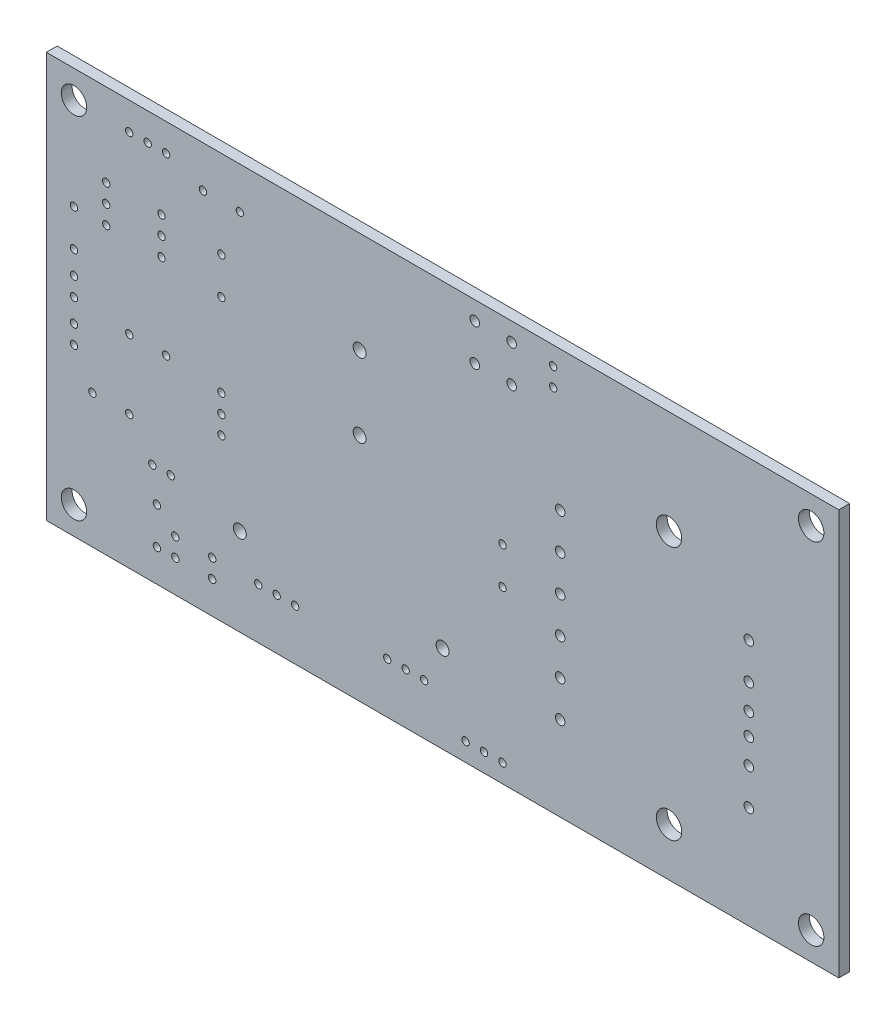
SolidWorks part; units mm, degrees
ref_plane "Спереди" through (0, 0, 0) normal (0, 0, 1) x (1, 0, 0)
ref_plane "Сверху" through (0, 0, 0) normal (0, 1, 0) x (1, 0, 0)
ref_plane "Справа" through (0, 0, 0) normal (1, 0, 0) x (0, 0, -1)
sketch "Эскиз1" plane through (0, 0, 0) normal (0, 0, 1) x (1, 0, 0)
  line L1 (0, 0) -> (109.22, 0)
  line L2 (0, 0) -> (0, -55.88)
  line L3 (0, -55.88) -> (109.22, -55.88)
  line L4 (109.22, 0) -> (109.22, -55.88)
extrude "Бобышка-Вытянуть1" add sketch "Эскиз1" along normal blind 1.4986
sketch "Эскиз2" plane through (0, 0, 1.4986) normal (0, 0, 1) x (1, 0, 0)
  circle A0 centre (3.81, -3.81) radius 1.7526
  circle A1 centre (3.81, -52.07) radius 1.7526
  circle A2 centre (105.41, -3.81) radius 1.7526
  circle A3 centre (105.41, -52.07) radius 1.7526
  circle A4 centre (11.43, -3.81) radius 0.508
  circle A5 centre (13.97, -3.81) radius 0.508
  circle A6 centre (16.51, -3.81) radius 0.508
  circle A7 centre (21.59, -5.715) radius 0.508
  circle A8 centre (26.67, -5.715) radius 0.508
  circle A9 centre (8.255, -11.43) radius 0.508
  circle A10 centre (8.255, -13.97) radius 0.508
  circle A11 centre (8.255, -16.51) radius 0.508
  circle A12 centre (15.875, -11.43) radius 0.508
  circle A13 centre (15.875, -13.97) radius 0.508
  circle A14 centre (15.875, -16.51) radius 0.508
  circle A15 centre (24.13, -12.065) radius 0.508
  circle A16 centre (24.13, -17.145) radius 0.508
  circle A17 centre (3.81, -16.51) radius 0.508
  circle A18 centre (3.81, -21.59) radius 0.508
  circle A19 centre (3.81, -24.765) radius 0.508
  circle A20 centre (3.81, -27.305) radius 0.508
  circle A21 centre (3.81, -30.48) radius 0.508
  circle A22 centre (3.81, -33.02) radius 0.508
  circle A23 centre (11.43, -27.94) radius 0.508
  circle A24 centre (16.51, -27.94) radius 0.508
  circle A25 centre (24.13, -28.575) radius 0.508
  circle A26 centre (24.13, -31.115) radius 0.508
  circle A27 centre (24.13, -33.655) radius 0.508
  circle A28 centre (6.35, -37.465) radius 0.508
  circle A29 centre (11.43, -37.465) radius 0.508
  circle A30 centre (14.605, -41.91) radius 0.508
  circle A31 centre (17.145, -41.91) radius 0.508
  circle A32 centre (15.24, -46.355) radius 0.508
  circle A33 centre (15.24, -51.435) radius 0.508
  circle A34 centre (17.78, -48.895) radius 0.508
  circle A35 centre (22.86, -48.895) radius 0.508
  circle A36 centre (17.78, -51.435) radius 0.508
  circle A37 centre (22.86, -51.435) radius 0.508
  circle A38 centre (26.67, -43.815) radius 0.889
  circle A39 centre (54.61, -43.815) radius 0.889
  circle A40 centre (29.21, -48.895) radius 0.508
  circle A41 centre (31.75, -48.895) radius 0.508
  circle A42 centre (34.29, -48.895) radius 0.508
  circle A43 centre (46.99, -48.895) radius 0.508
  circle A44 centre (49.53, -48.895) radius 0.508
  circle A45 centre (52.07, -48.895) radius 0.508
  circle A46 centre (57.785, -53.34) radius 0.508
  circle A47 centre (60.325, -53.34) radius 0.508
  circle A48 centre (62.865, -53.34) radius 0.508
  circle A49 centre (62.865, -32.385) radius 0.508
  circle A50 centre (62.865, -27.305) radius 0.508
  circle A51 centre (43.18, -24.13) radius 0.889
  circle A52 centre (43.18, -13.97) radius 0.889
  circle A53 centre (59.055, -2.54) radius 0.6604
  circle A54 centre (64.135, -2.54) radius 0.6604
  circle A55 centre (59.055, -7.62) radius 0.6604
  circle A56 centre (64.135, -7.62) radius 0.6604
  circle A57 centre (69.85, -2.54) radius 0.508
  circle A58 centre (69.85, -5.08) radius 0.508
  circle A59 centre (70.8203, -19.2507) radius 0.6604
  circle A60 centre (70.8203, -24.2494) radius 0.6604
  circle A61 centre (70.8203, -29.2506) radius 0.6604
  circle A62 centre (70.8203, -34.2494) radius 0.6604
  circle A63 centre (70.8203, -39.2506) radius 0.6604
  circle A64 centre (70.8203, -44.2493) radius 0.6604
  circle A65 centre (96.8197, -21.75) radius 0.6604
  circle A66 centre (96.8197, -26.7487) radius 0.6604
  circle A67 centre (96.8197, -30.2489) radius 0.6604
  circle A68 centre (96.8197, -33.2511) radius 0.6604
  circle A69 centre (96.8197, -36.7513) radius 0.6604
  circle A70 centre (85.819, -14.2494) radius 1.7526
  circle A71 centre (85.819, -49.2506) radius 1.7526
  circle A72 centre (96.8197, -41.75) radius 0.6604
extrude "Вырез-Вытянуть1" cut sketch "Эскиз2" against normal up to surface (1.4986 mm away)
